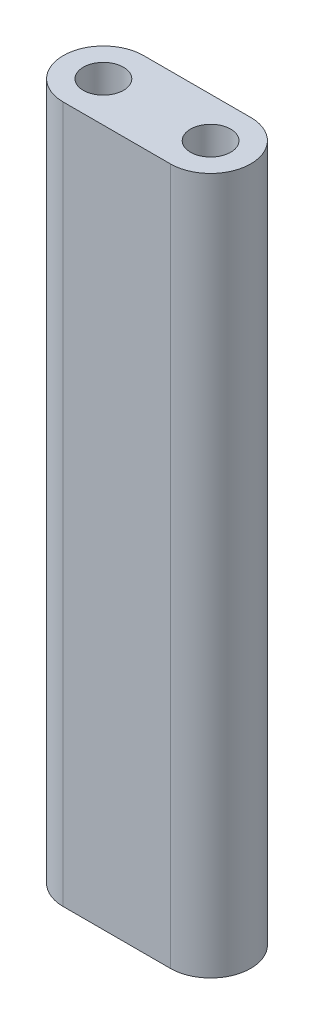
SolidWorks part; units mm, degrees
ref_plane "Front Plane" through (0, 0, 0) normal (0, 0, 1) x (1, 0, 0)
ref_plane "Top Plane" through (0, 0, 0) normal (0, 1, 0) x (1, 0, 0)
ref_plane "Right Plane" through (0, 0, 0) normal (1, 0, 0) x (0, 0, -1)
sketch "Sketch1" plane through (0, 0, 0) normal (0, 1, 0) x (1, 0, 0)
  line L0 (-2.7664, 3) -> (5.2336, 3)
  line L1 (-2.7664, -3) -> (5.2336, -3)
  circle A0 centre (-2.7664, 0) radius 1.5
  circle A1 centre (5.2336, 0) radius 1.5
  circle A2 centre (-2.7664, 0) radius 3
  circle A3 centre (5.2336, 0) radius 3
  dimension "D1" = 3
  dimension "D2" = 3
  dimension "D4" = 6
  dimension "D5" = 6
  dimension "D3" = 8
extrude "Boss-Extrude1" add sketch "Sketch1" along normal blind 52 contours A2 A0 | A3 L0 A2 L1 | A3 A1
